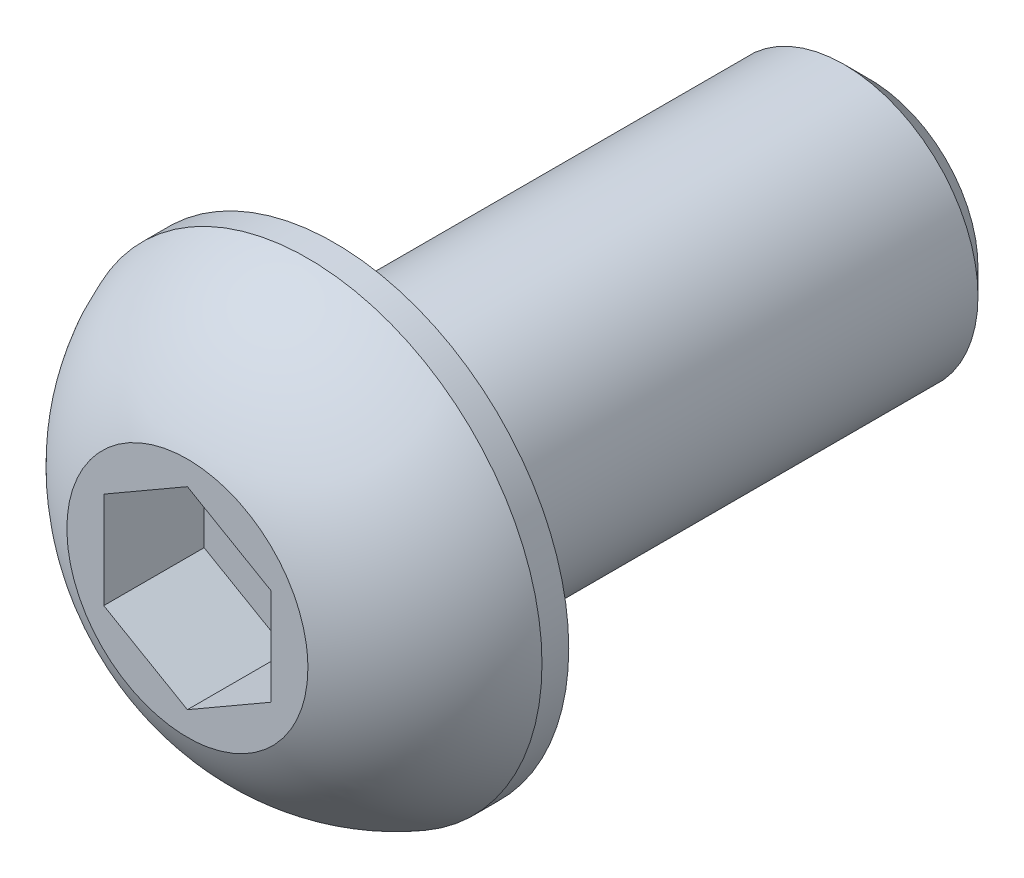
SolidWorks part; units mm, degrees
other "item_8000018_Halbrundschraube M8x14"
ref_plane "Ebene vorne" through (0, 0, 0) normal (0, 0, 1) x (1, 0, 0)
ref_plane "Ebene oben" through (0, 0, 0) normal (0, 1, 0) x (1, 0, 0)
ref_plane "Ebene rechts" through (0, 0, 0) normal (1, 0, 0) x (0, 0, -1)
imported_body "Importiert1"
other "Fläche verschieben1" parameters "D1"=2
